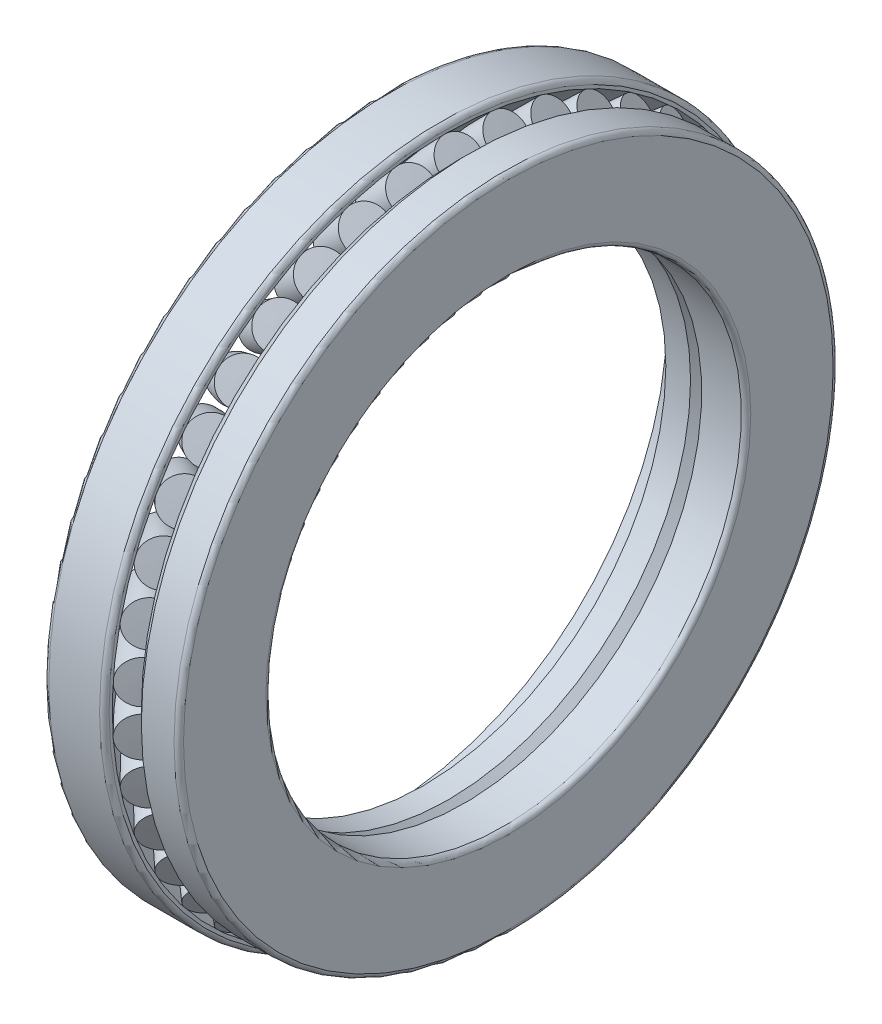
SolidWorks part; units mm, degrees
ref_plane "Front" through (0, 0, 0) normal (0, 0, 1) x (1, 0, 0)
ref_plane "Top" through (0, 0, 0) normal (0, 1, 0) x (1, 0, 0)
ref_plane "Right" through (0, 0, 0) normal (1, 0, 0) x (0, 0, -1)
sketch "Sketch1" plane through (0, 0, 0) normal (0, 0, 1) x (1, 0, 0)
  line L0 (-62.4031, 0) -> (236.3817, 0) construction
  line L1 (-20, 89) -> (-20, 106)
  line L2 (-18.5, 107.5) -> (-2.5, 107.5)
  line L3 (-1, 106) -> (-1, 105)
  line L4 (-15.2239, 89) -> (-20, 89)
  line L5 (101, 109.7192) -> (101, -154.5754) construction
  line L6 (19, 76.5) -> (19, 102.5)
  line L7 (17.5, 104) -> (7.1924, 104)
  line L8 (-1, 105) -> (8.1924, 95.8076)
  line L9 (-13.2239, 91.5527) -> (-5.2549, 83.5837)
  line L10 (-7.8076, 81.5837) -> (-7.8076, 76.5)
  line L11 (5, 75) -> (17.5, 75)
  line L12 (3.5962, 100.4038) -> (-9.2394, 87.5682) construction
  line L13 (7.1924, 104) -> (3.5962, 100.4038)
  line L14 (-7.8076, 76.5) -> (0, 76.5)
  line L15 (0, 76.5) -> (2.5, 79.0418)
  line L16 (2.5, 79.0418) -> (5, 75)
  arc A0 (-15.2239, 89) -> (-1, 105) centre (101, 0) cw
  arc A1 (-7.8076, 81.5837) -> (8.1924, 95.8076) centre (-96.8076, 197.8076) ccw
  arc A2 (-18.5, 107.5) -> (-20, 106) centre (-18.5, 106) ccw
  arc A3 (-1, 106) -> (-2.5, 107.5) centre (-2.5, 106) ccw
  arc A4 (19, 102.5) -> (17.5, 104) centre (17.5, 102.5) ccw
  arc A5 (17.5, 75) -> (19, 76.5) centre (17.5, 76.5) ccw
  point P24 (3.5962, 100.4038)
  point P27 (-7.8076, 79.0418)
  point P34 (-1, 107.5)
  point P39 (19, 75)
  dimension "D2" = 5
  dimension "dr" = 146.3865
  dimension "xr" = 1.5
  dimension "D1" = 45
  dimension "dd" = 215
  dimension "xd1" = 178
  dimension "dc" = 19
  dimension "xd" = 150
  dimension "dd1" = 208
  dimension "dt" = 39
  dimension "da" = 82
  dimension "1/3dt" = 13
  dimension "xd+3" = 153
  dimension "db" = 14
  dimension "D3" = 2.5
  dimension "D4" = 2
  dimension "zj" = 175.1364
  dimension "SR+1" = 2.5
revolve "Revolve1" add sketch "Sketch1" angle 360 about L0
sketch "Sketch2" plane through (0, 0, 0) normal (0, 0, 1) x (1, 0, 0)
  line L0 (3.5962, 100.4038) -> (-9.2394, 87.5682) construction
  line L1 (-13.2239, 91.5527) -> (-5.2549, 83.5837) construction
  line L2 (-9.2394, 87.5682) -> (10.0306, 106.8383) construction
  line L3 (3.5962, 100.4038) -> (-9.2394, 87.5682)
  line L4 (-13.2239, 91.5527) -> (-9.2394, 87.5682)
  line L5 (-1.0671, 104.9348) -> (3.5962, 100.4038)
  arc A1 (-1.0671, 104.9348) -> (-13.2239, 91.5527) centre (101, 0) ccw
  arc A2 (-1, 105) -> (-15.2239, 89) centre (101, 0) ccw construction
  dimension "1/2gj" = 6.502
revolve "Revolve2" add sketch "Sketch2" angle 360 about L2
pattern_circular "Circular-Pattern1" count 42 over 360 about axis through (0, 0, 0) along (1, 0, 0)
sketch "Sketch3" plane through (0, 0, 0) normal (0, 0, 1) x (1, 0, 0)
  line L0 (-7.8076, 81.5837) -> (-7.8076, 76.5) construction
  line L1 (-7.8076, 76.5) -> (0, 76.5) construction
  line L2 (2.5, 79.0418) -> (5, 75) construction
  line L3 (0, 76.5) -> (2.5, 79.0418) construction
  line L4 (5, 75) -> (17.5, 75) construction
  line L5 (19, 76.5) -> (19, 102.5) construction
  line L6 (-1, 105) -> (8.1924, 95.8076) construction
  line L7 (7.1924, 104) -> (3.5962, 100.4038) construction
  line L8 (17.5, 104) -> (7.1924, 104) construction
  line L9 (-7.8076, 81.5837) -> (-7.8076, 76.5)
  line L10 (-7.8076, 76.5) -> (0, 76.5)
  line L11 (2.5, 79.0418) -> (5, 75)
  line L12 (0, 76.5) -> (2.5, 79.0418)
  line L13 (5, 75) -> (17.5, 75)
  line L14 (19, 76.5) -> (19, 102.5)
  line L15 (3.5962, 100.4038) -> (8.1924, 95.8076)
  line L16 (7.1924, 104) -> (3.5962, 100.4038)
  line L17 (17.5, 104) -> (7.1924, 104)
  arc A0 (-7.8076, 81.5837) -> (8.1924, 95.8076) centre (-96.8076, 197.8076) ccw construction
  arc A1 (17.5, 75) -> (19, 76.5) centre (17.5, 76.5) ccw construction
  arc A2 (19, 102.5) -> (17.5, 104) centre (17.5, 102.5) ccw construction
  arc A3 (-7.8076, 81.5837) -> (8.1924, 95.8076) centre (-96.8076, 197.8076) ccw
  arc A4 (17.5, 75) -> (19, 76.5) centre (17.5, 76.5) ccw
  arc A5 (19, 102.5) -> (17.5, 104) centre (17.5, 102.5) ccw
revolve "Revolve3" add sketch "Sketch3" angle 360 about L0
equation "\"SR+1@Sketch1\" = \"XR@Sketch1\"+1"
equation "\"1/3dt@Sketch1\" = \"dt@Sketch1\" / 3"
equation "\"D2@Sketch1\" =  \"db@Sketch1\" / 2 - 2"
equation "\"D3@Sketch1\" = \"D2@Sketch1\" / 2"
equation "\"xd+3@Sketch1\" = \"xd@Sketch1\"  +  3"
equation "\"D1@Circular-Pattern1\" = int( 3.14159265 / atn(( \"1/3dt@Sketch1\"/ 2) / sqr( \"xd1@Sketch1\" * \"xd1@Sketch1\"/4 - ( \"1/3dt@Sketch1\"/ 2) *  ( \"1/3dt@Sketch1\"/ 2))))"
equation "\"1/2gj@Sketch2\" = \"1/3dt@Sketch1\" / 2 + 0.002"
